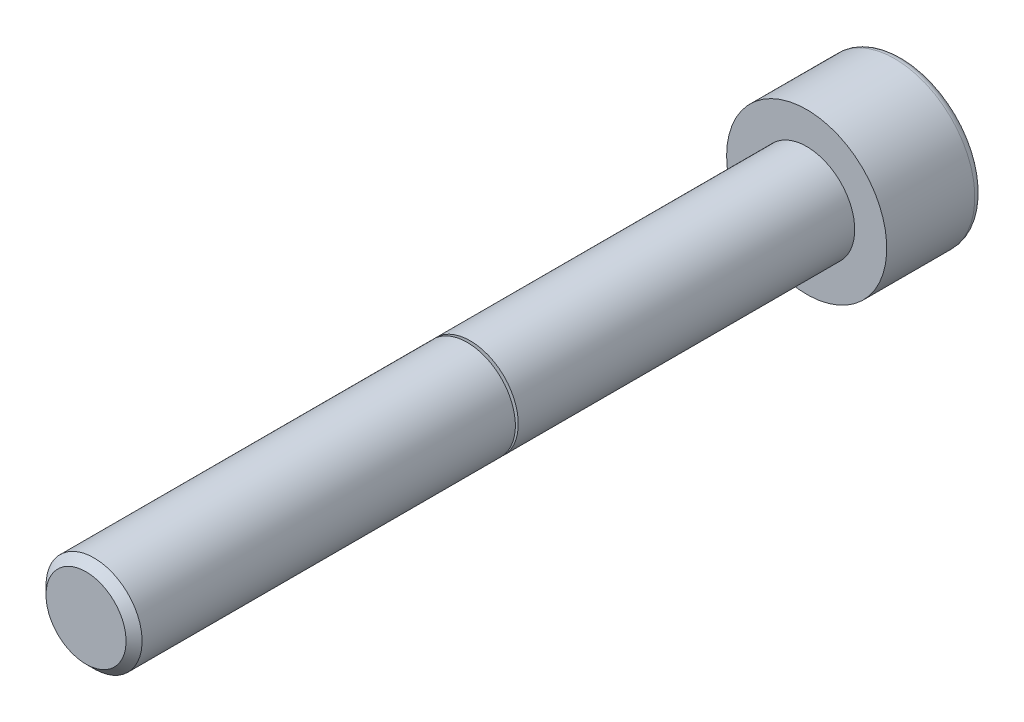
SolidWorks part; units mm, degrees
ref_plane "Front" through (0, 0, 0) normal (0, 0, 1) x (1, 0, 0)
ref_plane "Top" through (0, 0, 0) normal (0, 1, 0) x (1, 0, 0)
ref_plane "Right" through (0, 0, 0) normal (1, 0, 0) x (0, 0, -1)
sketch "Logo3_Revol_Axis" plane through (0, 0, 0) normal (0, 1, 0) x (1, 0, 0)
  line L0 (0, -43.5172) -> (0, 43.5172) construction
sketch "Logo3_bib1" plane through (0, 0, 0) normal (0, -1, 0) x (-1, 0, 0)
  line L0 (0, -45) -> (0, 6)
  line L1 (0, 6) -> (4.5, 6)
  line L2 (5, 5.5) -> (5, 0)
  line L3 (5, 0) -> (3, 0)
  line L4 (3, 0) -> (3, -21.01)
  line L5 (3, -44.5) -> (2.5, -45)
  line L6 (2.5, -45) -> (0, -45)
  line L7 (3, -21.01) -> (2.6134, -21.01)
  line L8 (2.6066, -21.0488) -> (3, -21.192)
  line L9 (3, -21.192) -> (3, -44.5)
  line L10 (0, 10.5852) -> (0, -63.2873) construction
  arc A0 (4.5, 6) -> (5, 5.5) centre (4.5, 5.5) cw
  arc A1 (2.6134, -21.01) -> (2.6066, -21.0488) centre (2.6134, -21.03) ccw
  point P17 (2.5, -21.01)
revolve "Revolve1" add sketch "Logo3_bib1" angle 360 about L10
sketch "Logo3_bib2" plane through (0, 0, -6) normal (0, 0, -1) x (1, 0, 0)
  line L1 (2.8868, 0) -> (1.4434, 2.5)
  line L2 (1.4434, 2.5) -> (-1.4434, 2.5)
  line L3 (-1.4434, 2.5) -> (-2.8868, 0)
  line L4 (-2.8868, 0) -> (-1.4434, -2.5)
  line L5 (-1.4434, -2.5) -> (1.4434, -2.5)
  line L6 (1.4434, -2.5) -> (2.8868, 0)
  circle A0 centre (0, 0) radius 2.5 construction
extrude "Cut-Extrude1" cut sketch "Logo3_bib2" against normal blind 2.5
equation "\"DIA2@Logo3_bib1\" = \"Logo3_d1-pas@Logo3_bib1\""
equation "\"LGT1@Logo3_bib1\" = \"Logo3_d1@Logo3_bib1\""
equation "\"D1@Cut-Extrude1\" = \"Logo3_c1@Logo3_bib2\"/2."
equation "\"D2@Cosmetic Thread1\" = \"Logo3_d1-pas@Logo3_bib1\""
